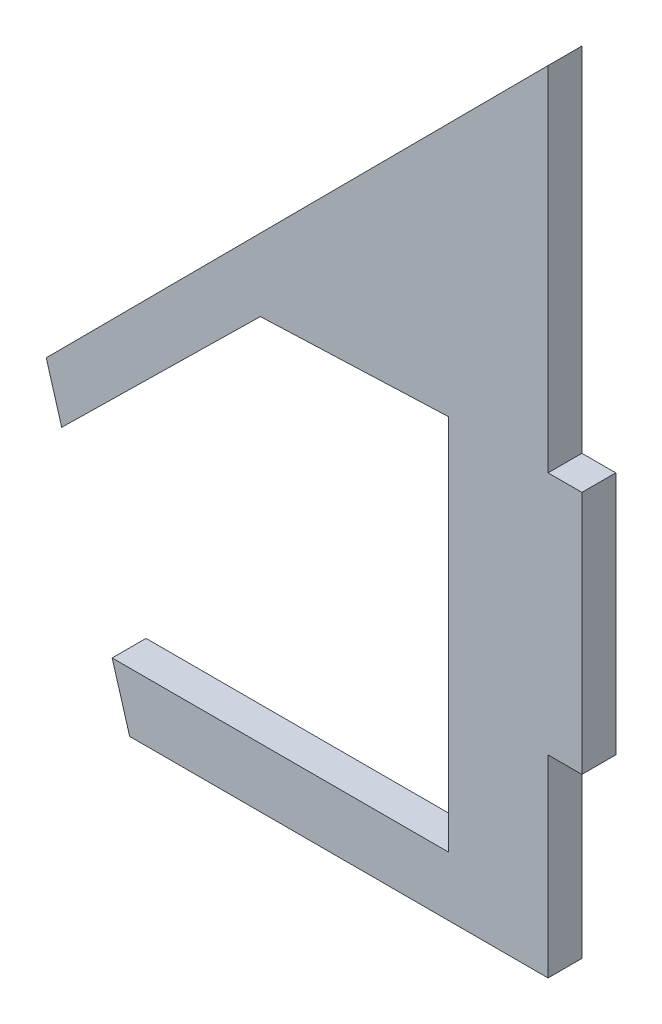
SolidWorks part; units mm, degrees
ref_plane "Front Plane" through (0, 0, 0) normal (0, 0, 1) x (1, 0, 0)
ref_plane "Top Plane" through (0, 0, 0) normal (0, 1, 0) x (1, 0, 0)
ref_plane "Right Plane" through (0, 0, 0) normal (1, 0, 0) x (0, 0, -1)
sketch "Sketch1" plane through (0, 0, 0) normal (0, 0, 1) x (1, 0, 0)
  line L0 (-0.8952, 47.5205) -> (-23.4827, 24.8351)
  line L1 (-0.8952, 31.645) -> (-0.8952, 47.5205)
  line L2 (0.6288, 31.645) -> (-0.8952, 31.645)
  line L3 (-0.8952, 11.9545) -> (-0.8952, 20.6514)
  line L4 (-22.7855, 22.4733) -> (-13.8458, 31.2603)
  line L5 (-13.8458, 31.2603) -> (-5.3767, 31.5935)
  line L6 (-5.3767, 31.5935) -> (-5.3767, 14.6208)
  line L7 (-5.3767, 14.6208) -> (-20.5146, 14.6208)
  line L8 (-22.7855, 22.4733) -> (-23.4827, 24.8351)
  line L9 (-20.5146, 14.6208) -> (-19.7275, 11.9545)
  line L10 (0.6288, 20.6514) -> (-0.8952, 20.6514)
  line L11 (-19.7275, 11.9545) -> (-0.8952, 11.9545)
  line L12 (0.6288, 20.6514) -> (0.6288, 31.645)
  point P6 (0.6288, 10.7921)
  point P11 (0.6288, 47.0154)
extrude "Boss-Extrude1" add sketch "Sketch1" along normal blind 1.524
